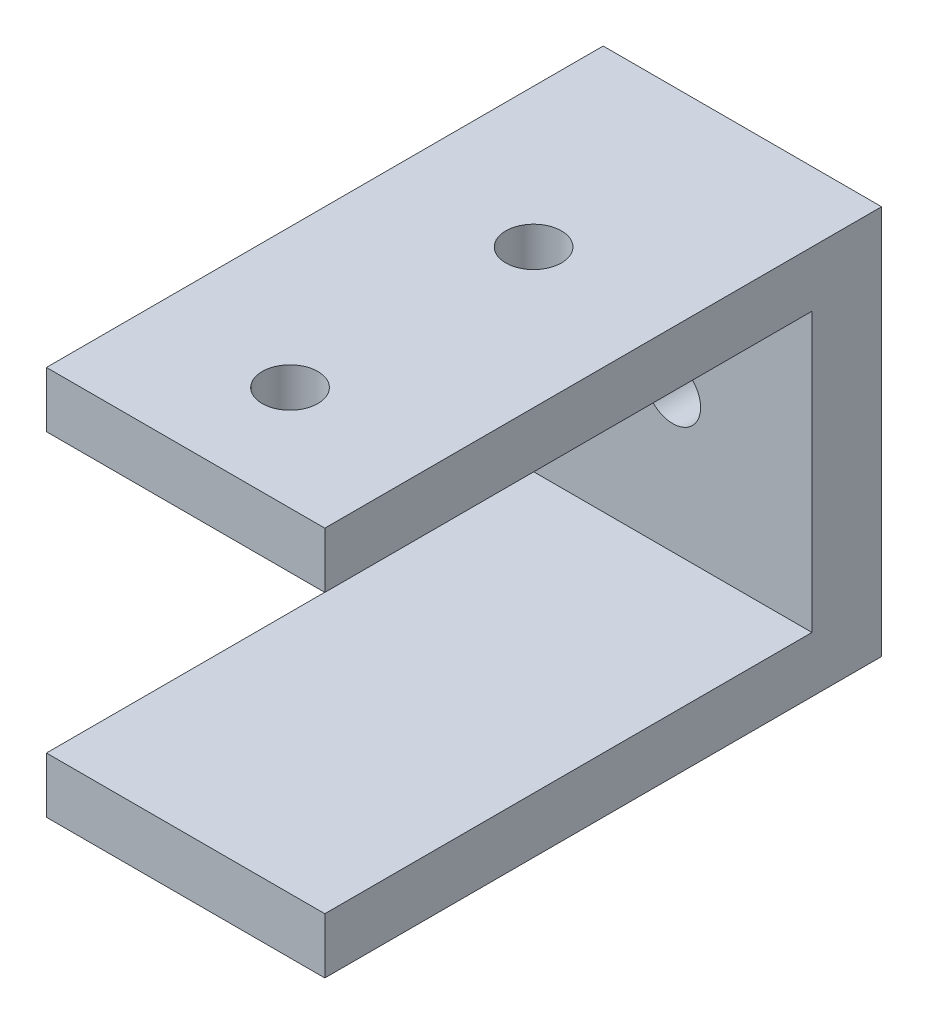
SolidWorks part; units mm, degrees
ref_plane "Alzado" through (0, 0, 0) normal (0, 0, 1) x (1, 0, 0)
ref_plane "Planta" through (0, 0, 0) normal (0, 1, 0) x (1, 0, 0)
ref_plane "Vista lateral" through (0, 0, 0) normal (1, 0, 0) x (0, 0, -1)
sketch "Sketch7" plane through (0, 0, 0) normal (1, 0, 0) x (0, 0, -1)
  line L0 (-25, 23.99) -> (-25, 19.99) construction
  line L1 (-25, 19.99) -> (-5, 19.99)
  line L2 (-5, 19.99) -> (-5, 0)
  line L3 (-5, 0) -> (-25, 0)
  line L4 (-25, 0) -> (-25, -4) construction
  line L5 (-25, -4) -> (0, -4)
  line L6 (0, -4) -> (0, 23.99)
  line L7 (0, 23.99) -> (-25, 23.99)
  line L8 (0, 0) -> (87.8092, 0) construction
  line L9 (-25, -4) -> (-40, -4)
  line L10 (0, -46.3065) -> (0, 45.8278) construction
  line L11 (-35, -4) -> (-35, 23.99) construction
  line L12 (-35, 23.99) -> (-25, 23.99) construction
  line L13 (-25, -4) -> (-35, -4) construction
  line L14 (-25, 0) -> (-25, 19.99) construction
  line L15 (-40, -4) -> (-40, 0)
  line L16 (-40, 0) -> (-25, 0)
  line L17 (-59.0433, 9.995) -> (6.549, 9.995) construction
  line L18 (-25, 23.99) -> (-40, 23.99)
  line L19 (-40, 23.99) -> (-40, 19.99)
  line L20 (-40, 19.99) -> (-25, 19.99)
  dimension "D8" = 9.995
  dimension "D1" = 4
  dimension "D2" = 19.99
  dimension "D3" = 4
  dimension "D4" = 20
  dimension "D5" = 90
  dimension "D6" = 5
  dimension "D7" = 10
  dimension "D9" = 180
  dimension "D10" = 15
extrude "Boss-Extrude3" add sketch "Sketch7" along normal blind 20
sketch "Sketch13" plane through (0, 23.99, 0) normal (0, 1, 0) x (1, 0, 0)
  line L0 (10, 0) -> (10, -40) construction
  line L3 (20, 0) -> (0, 0) construction
  line L4 (20, 0) -> (20, -40) construction
  line L5 (0, -25) -> (20, -25) construction
  line L6 (0, 0) -> (0, -40) construction
  line L7 (0, -5) -> (20, -5) construction
  line L8 (0, 0) -> (0, -40) construction
  line L9 (20, 0) -> (20, -40) construction
  line L10 (0, -15) -> (20, -15) construction
  line L11 (20, -40) -> (0, -40) construction
  line L12 (0, -32.5) -> (20, -32.5) construction
  circle A0 centre (10, -15) radius 2
  circle A1 centre (10, -32.5) radius 2
  dimension "D3" = 4
  dimension "D5" = 10
  dimension "D7" = 4
  dimension "D1" = 5
  dimension "D2" = 20
  dimension "D4" = 10
  dimension "D6" = 7.5
sketch "Sketch14" plane through (0, 0, 0) normal (0, 0, -1) x (-1, 0, 0)
  line L0 (-20, 19.99) -> (0, 19.99) construction
  line L1 (-20, -4) -> (-20, 23.99) construction
  line L2 (0, -4) -> (0, 23.99) construction
  line L3 (-20, 23.99) -> (0, 23.99) construction
  line L4 (-20, 0) -> (0, 0) construction
  line L6 (-10, 23.99) -> (-10, -4) construction
  line L7 (-20, -4) -> (0, -4) construction
  circle A0 centre (-10, 9.995) radius 2
  dimension "D2" = 4
  dimension "D1" = 4
extrude "Cut-Extrude5" cut sketch "Sketch14" against normal blind 10
extrude "Cut-Extrude6" cut sketch "Sketch13" against normal blind 10
